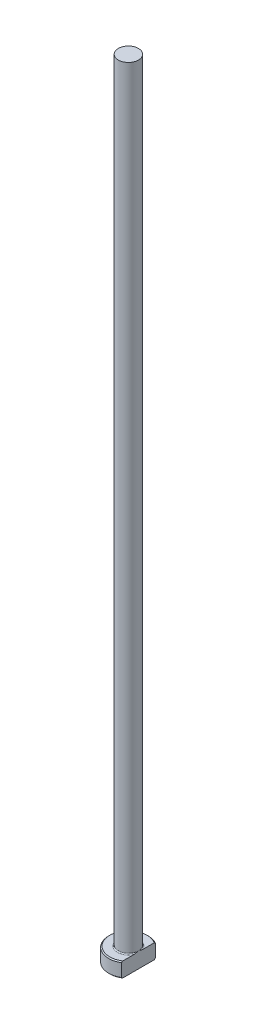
SolidWorks part; units mm, degrees
ref_plane "Front Plane" through (0, 0, 0) normal (0, 0, 1) x (1, 0, 0)
ref_plane "Top Plane" through (0, 0, 0) normal (0, 1, 0) x (1, 0, 0)
ref_plane "Right Plane" through (0, 0, 0) normal (1, 0, 0) x (0, 0, -1)
sketch "Sketch1" plane through (0, 0, 0) normal (0, 0, 1) x (1, 0, 0)
  line L0 (0, 259.9588) -> (0, -15.1925) construction
  line L1 (0, 0) -> (-4, 0)
  line L2 (-4, 0) -> (-4, 3)
  line L3 (-4, 3) -> (-2.05, 3)
  line L4 (-2.05, 3) -> (-2.05, 160)
  line L5 (-2.05, 160) -> (0, 160)
  line L6 (0, 160) -> (0, 0)
  dimension "L" = 160
  dimension "H" = 8
  dimension "T" = 3
  dimension "D" = 4.1
revolve "Revolve1" add sketch "Sketch1" angle 360 about L0
chamfer "Chamfer1" distance 0.2 angle 45 2 edges at (0, 3, 4) (0, 0, 4)
fillet "Fillet1" radius 0.2 1 edges at (0, 3, 2.05)
sketch "Sketch2" plane through (0, 0, 0) normal (0, 1, 0) x (1, 0, 0)
  line L0 (2.05, 3.4347) -> (2.05, -3.4347)
  circle A0 centre (0, 0) radius 4 construction
  arc A1 (2.05, -3.4347) -> (2.05, 3.4347) centre (0, 0) ccw
  circle A2 centre (0, 0) radius 2.05 construction
extrude "KEY" cut sketch "Sketch2" along normal through all
